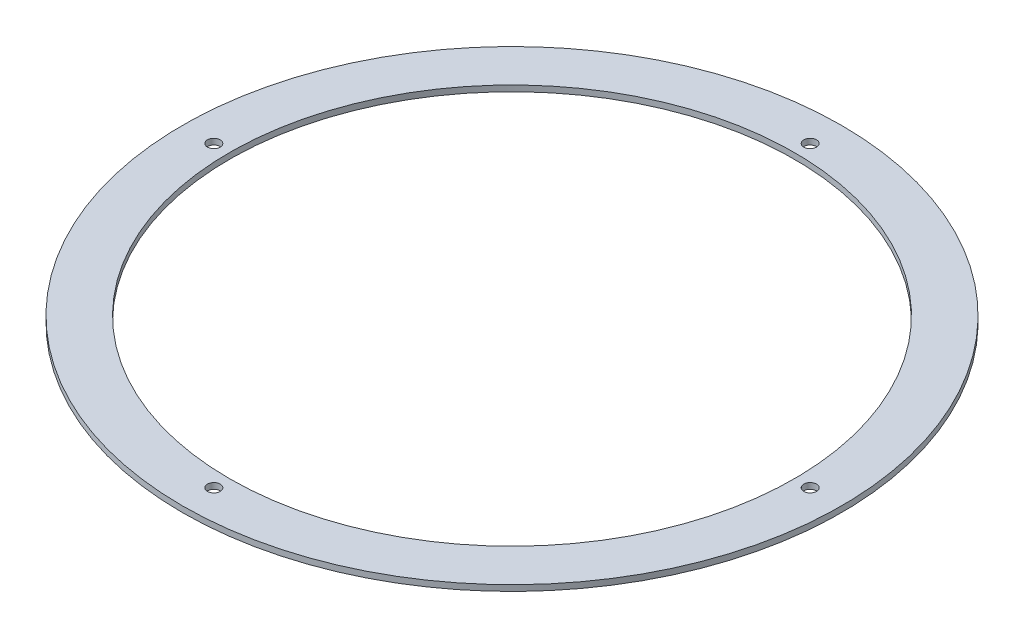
SolidWorks part; units mm, degrees
ref_plane "Front Plane" through (0, 0, 0) normal (0, 0, 1) x (1, 0, 0)
ref_plane "Top Plane" through (0, 0, 0) normal (0, 1, 0) x (1, 0, 0)
ref_plane "Right Plane" through (0, 0, 0) normal (1, 0, 0) x (0, 0, -1)
sketch "Sketch1" plane through (0, 0, 0) normal (0, 1, 0) x (1, 0, 0)
  circle A0 centre (0, 0) radius 457.2
  circle A1 centre (0, 0) radius 533.4
  dimension "D1" = 1066.8
  dimension "D2" = 914.4
extrude "Extrude1" add sketch "Sketch1" against normal blind 9.525
sketch "Sketch2" plane through (0, 0, 0) normal (0, 1, 0) x (-1, 0, 0)
  circle A0 centre (0, -482.6) radius 10.3124
  dimension "D1" = 482.6
extrude "Cut-Extrude1" cut sketch "Sketch2" against normal through all
pattern_circular "CirPattern1" count 4 over 360 about axis through (0, 0, 0) along (0, 1, 0) of "Cut-Extrude1"
